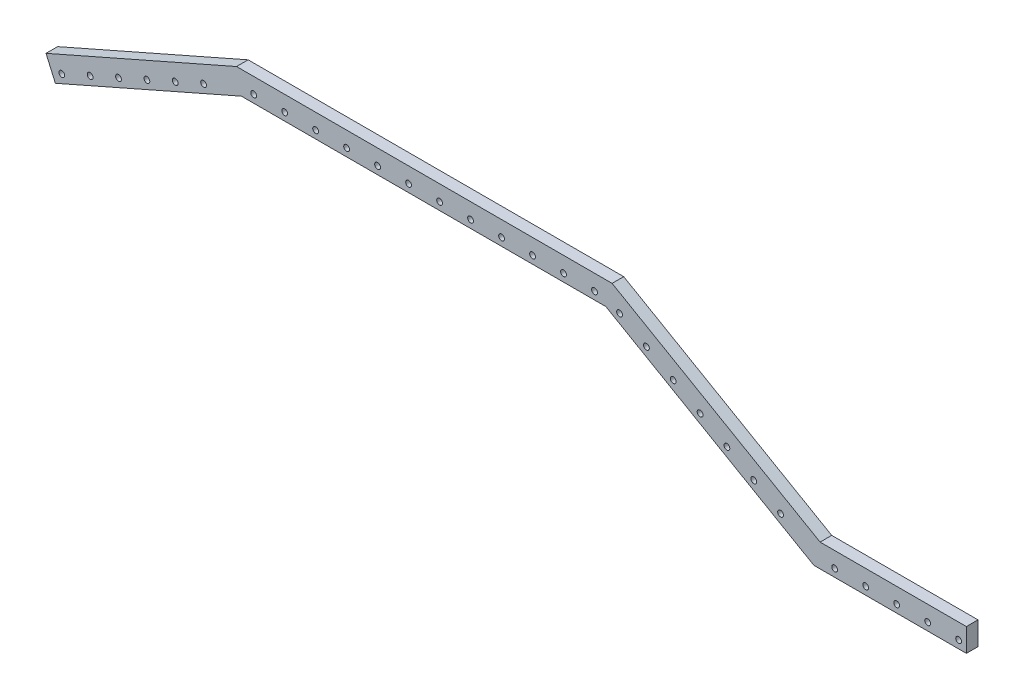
SolidWorks part; units mm, degrees
ref_plane "Front Plane" through (0, 0, 0) normal (0, 0, 1) x (1, 0, 0)
ref_plane "Top Plane" through (0, 0, 0) normal (0, 1, 0) x (1, 0, 0)
ref_plane "Right Plane" through (0, 0, 0) normal (1, 0, 0) x (0, 0, -1)
sketch "Sketch1" plane through (0, 0, 0) normal (0, 0, 1) x (1, 0, 0)
  line L4 (-786.1648, 23.356) -> (-629.9852, 92.075)
  line L5 (-629.9852, 92.075) -> (-322.1485, 92.075)
  line L6 (-322.1485, 92.075) -> (-151.6714, -6.35)
  line L7 (-151.6714, -6.35) -> (-31.75, -6.35)
  line L8 (-151.6714, -25.4) -> (-31.75, -25.4)
  line L9 (-327.253, 73.025) -> (-161.1964, -22.8478)
  line L10 (-625.9795, 73.025) -> (-327.253, 73.025)
  line L11 (-778.4926, 5.9192) -> (-625.9795, 73.025)
  line L12 (-151.6714, -25.4) -> (-31.75, -25.4)
  line L13 (-327.253, 73.025) -> (-161.1964, -22.8478)
  line L14 (-625.9795, 73.025) -> (-327.253, 73.025)
  line L15 (-778.4926, 5.9192) -> (-625.9795, 73.025)
  line L16 (-161.1964, -22.8478) -> (-156.7759, -25.4)
  line L17 (-151.6714, -25.4) -> (-156.7759, -25.4)
  line L18 (-31.75, -6.35) -> (-31.75, -25.4)
  line L19 (-786.1648, 23.356) -> (-778.4926, 5.9192)
  arc A3 (-151.6714, -6.35) -> (-151.6714, -6.35) centre (-151.6714, -6.35) ccw
  arc A6 (-161.1964, -22.8478) -> (-151.6714, -25.4) centre (-151.6714, -6.35) ccw
  arc A8 (-161.1964, -22.8478) -> (-151.6714, -25.4) centre (-151.6714, -6.35) ccw construction
  dimension "D1" = 12.7
  dimension "D2" = 19.05
extrude "Boss-Extrude1" add sketch "Sketch1" along normal blind 9.525
sketch "Sketch2" plane through (0, 0, 0) normal (0, 0, -1) x (-1, 0, 0)
  circle A0 centre (773.2181, 15.1775) radius 2.3813 construction
  circle A1 centre (749.9691, 25.4071) radius 2.3813 construction
  circle A2 centre (726.7201, 35.6367) radius 2.3813 construction
  circle A3 centre (703.4711, 45.8662) radius 2.3813 construction
  circle A4 centre (680.2221, 56.0958) radius 2.3813 construction
  circle A5 centre (656.9731, 66.3253) radius 2.3813 construction
  circle A6 centre (615.95, 79.375) radius 2.3813 construction
  circle A7 centre (590.55, 79.375) radius 2.3813 construction
  circle A8 centre (565.15, 79.375) radius 2.3813 construction
  circle A9 centre (539.75, 79.375) radius 2.3812 construction
  circle A10 centre (514.35, 79.375) radius 2.3813 construction
  circle A11 centre (488.95, 79.375) radius 2.3812 construction
  circle A12 centre (463.55, 79.375) radius 2.3812 construction
  circle A13 centre (438.15, 79.375) radius 2.3812 construction
  circle A14 centre (412.75, 79.375) radius 2.3812 construction
  circle A15 centre (387.35, 79.375) radius 2.3812 construction
  circle A16 centre (361.95, 79.375) radius 2.3812 construction
  circle A17 centre (336.55, 79.375) radius 2.3812 construction
  circle A18 centre (316.0265, 73.8757) radius 2.3813 construction
  circle A19 centre (294.0294, 61.1757) radius 2.3813 construction
  circle A20 centre (272.0324, 48.4757) radius 2.3813 construction
  circle A21 centre (250.0353, 35.7757) radius 2.3813 construction
  circle A22 centre (228.0383, 23.0757) radius 2.3813 construction
  circle A23 centre (206.0413, 10.3757) radius 2.3813 construction
  circle A24 centre (184.0442, -2.3243) radius 2.3813 construction
  circle A25 centre (139.7, -19.05) radius 2.3813 construction
  circle A26 centre (114.3, -19.05) radius 2.3813 construction
  circle A27 centre (88.9, -19.05) radius 2.3812 construction
  circle A28 centre (63.5, -19.05) radius 2.3813 construction
  circle A29 centre (38.1, -19.05) radius 2.3813 construction
  circle A30 centre (773.2181, 15.1775) radius 2.3812
  circle A31 centre (749.9691, 25.4071) radius 2.3812
  circle A32 centre (726.7201, 35.6367) radius 2.3812
  circle A33 centre (703.4711, 45.8662) radius 2.3812
  circle A34 centre (680.2221, 56.0958) radius 2.3812
  circle A35 centre (656.9731, 66.3253) radius 2.3812
  circle A36 centre (615.95, 79.375) radius 2.3812
  circle A37 centre (590.55, 79.375) radius 2.3812
  circle A38 centre (565.15, 79.375) radius 2.3812
  circle A39 centre (539.75, 79.375) radius 2.3812
  circle A40 centre (514.35, 79.375) radius 2.3812
  circle A41 centre (488.95, 79.375) radius 2.3812
  circle A42 centre (463.55, 79.375) radius 2.3812
  circle A43 centre (438.15, 79.375) radius 2.3812
  circle A44 centre (412.75, 79.375) radius 2.3812
  circle A45 centre (387.35, 79.375) radius 2.3812
  circle A46 centre (361.95, 79.375) radius 2.3812
  circle A47 centre (336.55, 79.375) radius 2.3812
  circle A48 centre (316.0265, 73.8757) radius 2.3813
  circle A49 centre (294.0294, 61.1757) radius 2.3813
  circle A50 centre (272.0324, 48.4757) radius 2.3813
  circle A51 centre (250.0353, 35.7757) radius 2.3813
  circle A52 centre (228.0383, 23.0757) radius 2.3813
  circle A53 centre (206.0413, 10.3757) radius 2.3813
  circle A54 centre (184.0442, -2.3243) radius 2.3813
  circle A55 centre (139.7, -19.05) radius 2.3813
  circle A56 centre (114.3, -19.05) radius 2.3813
  circle A57 centre (88.9, -19.05) radius 2.3812
  circle A58 centre (63.5, -19.05) radius 2.3813
  circle A59 centre (38.1, -19.05) radius 2.3812
extrude "Cut-Extrude1" cut sketch "Sketch2" against normal through all
